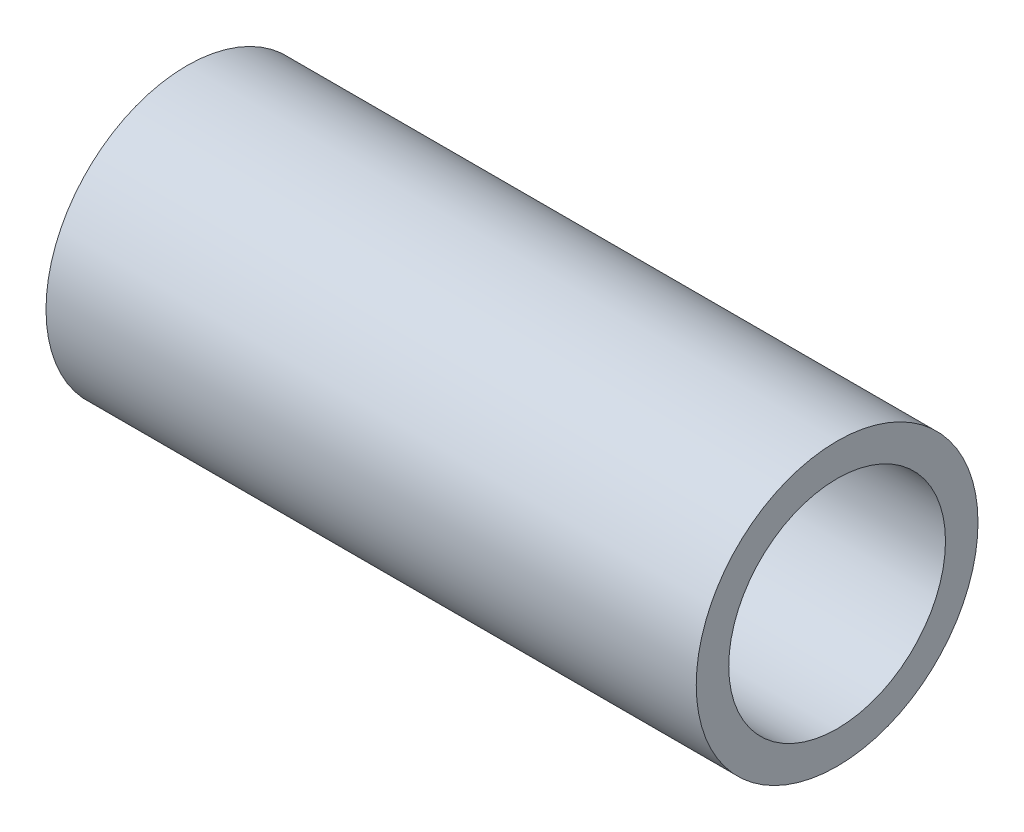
SolidWorks part; units mm, degrees
ref_plane "Front" through (0, 0, 0) normal (0, 0, 1) x (1, 0, 0)
ref_plane "Top" through (0, 0, 0) normal (0, 1, 0) x (1, 0, 0)
ref_plane "Right" through (0, 0, 0) normal (1, 0, 0) x (0, 0, -1)
sketch "Sketch1" plane through (0, 0, 0) normal (0, 0, 1) x (1, 0, 0)
  line L0 (0, 0) -> (76.2, 0)
  line L1 (9.9848, 0) -> (-9.9848, 0) construction
  dimension "D1" = 76.2
other "Structural Member1"
ref_plane "Plane1" through (0, 0, 0) normal (1, 0, 0) x (0, 0, -1)
sketch "Sketch11" plane through (0, 0, 0) normal (1, 0, 0) x (0, 0, -1)
  circle A0 centre (0, 0) radius 12.7
  circle A1 centre (0, 0) radius 16.51
  point P3 (0, 0)
  dimension "D1" = 33.02
  dimension "D2" = 25.4
